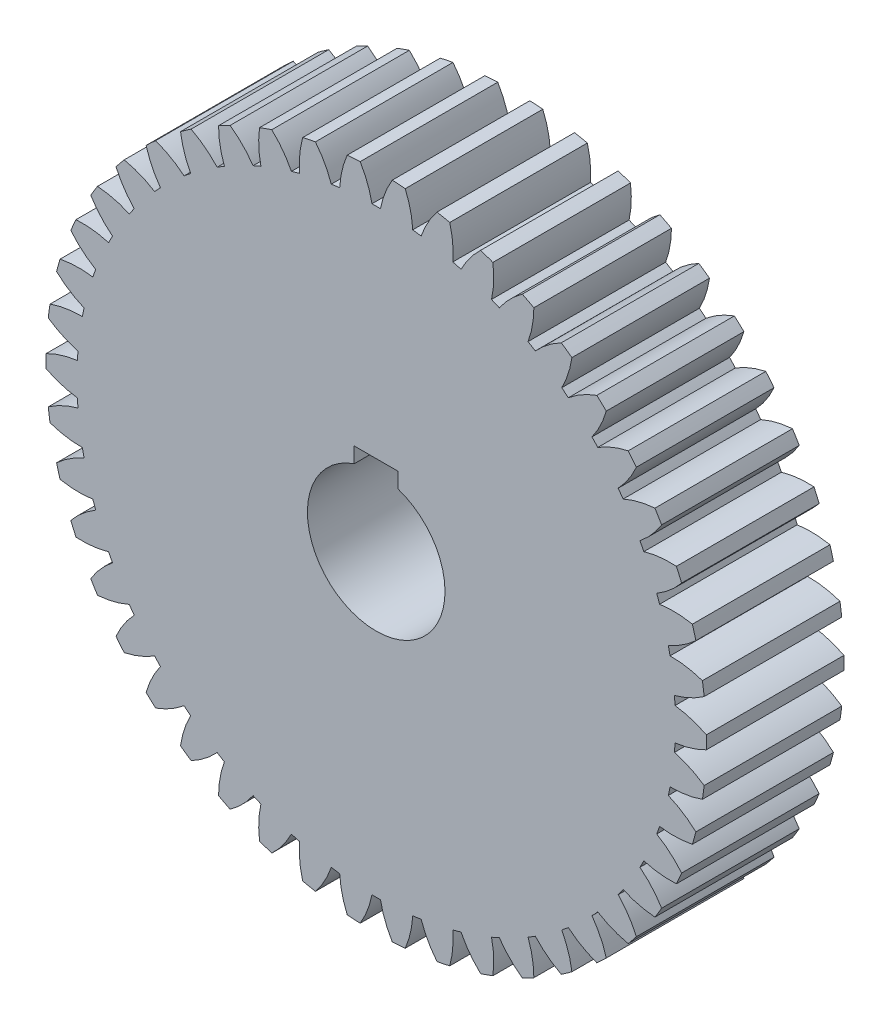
SolidWorks part; units mm, degrees
ref_plane "Front" through (0, 0, 0) normal (0, 0, 1) x (1, 0, 0)
ref_plane "Top" through (0, 0, 0) normal (0, 1, 0) x (1, 0, 0)
ref_plane "Right" through (0, 0, 0) normal (1, 0, 0) x (0, 0, -1)
sketch "Sketch1" plane through (0, 0, 0) normal (0, 0, 1) x (1, 0, 0)
  circle A0 centre (0, 0) radius 120
  dimension "D1" = 240
extrude "Boss-Extrude1" add sketch "Sketch1" along normal blind 50
sketch "Sketch2" plane through (0, 0, 50) normal (0, 0, 1) x (1, 0, 0)
  line L0 (0, 0) -> (0, 84.7584) construction
  line L1 (0, 0) -> (-10.1049, 159.1058) construction
  line L2 (0, 0) -> (-3.3797, 114.9503) construction
  circle A0 centre (0, 0) radius 115 construction
  arc A1 (1.5465, 108.738) -> (-1.5465, 108.738) centre (0, 0) ccw
  arc A3 (5.8303, 119.8583) -> (-5.8303, 119.8583) centre (0, 0) ccw
  arc A4 (-5.8303, 119.8583) -> (-1.5465, 108.738) centre (-34.9247, 102.2653) cw
  arc A5 (5.8303, 119.8583) -> (1.5465, 108.738) centre (34.9247, 102.2653) ccw
  circle A6 centre (0, 0) radius 108.0645 construction
  circle A8 centre (0, 0) radius 120 construction
  dimension "D1" = 34
  dimension "D2" = 217.498
  dimension "D3" = 230
  dimension "D4" = 216.129
  dimension "D5" = 3.634
  dimension "D6" = 3.913
extrude "Cut-Extrude1" cut sketch "Sketch2" against normal up to next
pattern_circular "CirPattern1" count 46 over 360 about axis through (0, 0, 0) along (0, 0, 1) of "Cut-Extrude1"
sketch "Sketch3" plane through (0, 0, 50) normal (0, 0, 1) x (1, 0, 0)
  line L0 (0, 0) -> (0, 124.4018) construction
  line L1 (-8, 29.3) -> (8, 29.3)
  line L2 (-8, 29.3) -> (-8, 23.6854)
  line L4 (8, 29.3) -> (8, 23.6854)
  arc A0 (-8, 23.6854) -> (8, 23.6854) centre (0, 0) ccw
  dimension "D1" = 25
  dimension "D2" = 29.3
  dimension "D3" = 16
extrude "Cut-Extrude2" cut sketch "Sketch3" against normal blind 50
